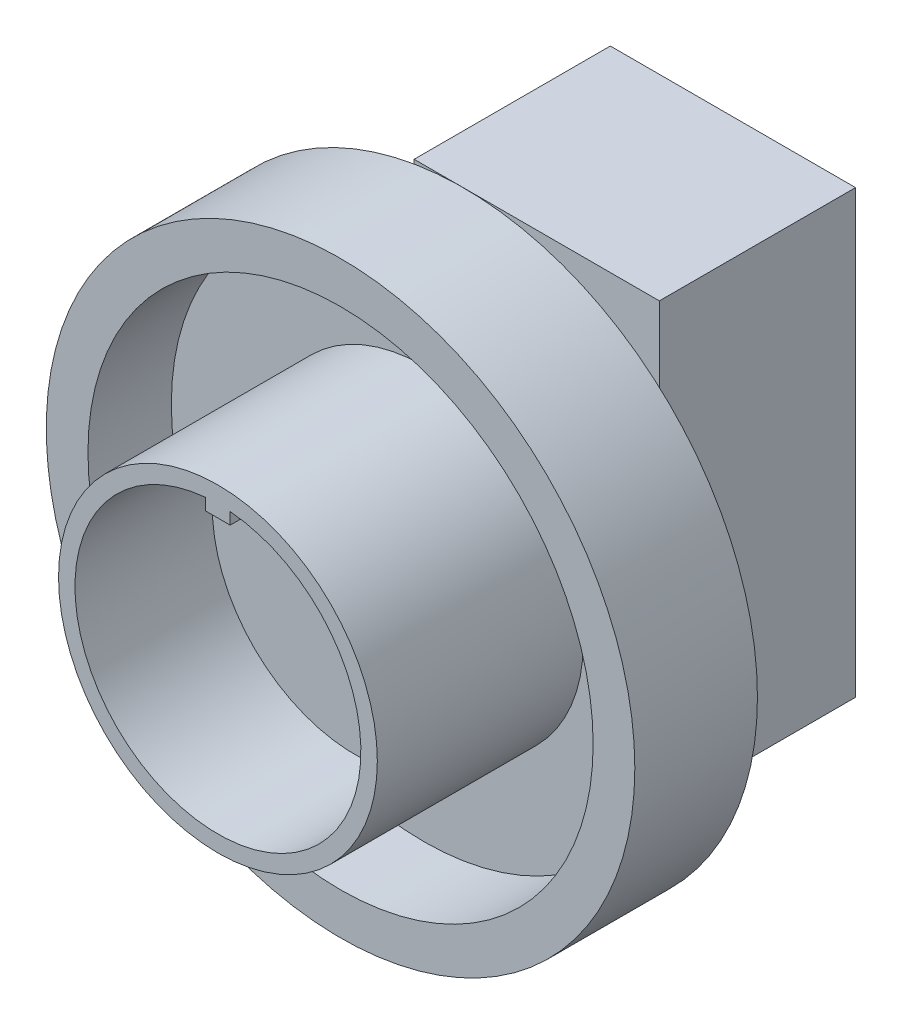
SolidWorks part; units mm, degrees
ref_plane "Alzado" through (0, 0, 0) normal (0, 0, 1) x (1, 0, 0)
ref_plane "Planta" through (0, 0, 0) normal (0, 1, 0) x (1, 0, 0)
ref_plane "Vista lateral" through (0, 0, 0) normal (1, 0, 0) x (0, 0, -1)
sketch "Croquis1" plane through (0, 0, 0) normal (1, 0, 0) x (0, 0, -1)
  line L0 (0, 0) -> (65, 0) construction
  line L1 (0, 32.5) -> (0, 29.15)
  line L2 (0, 29.15) -> (28, 29.15)
  line L3 (28, 29.15) -> (28, 0)
  line L4 (28, 0) -> (65, 0)
  line L5 (65, 0) -> (65, 25)
  line L6 (65, 25) -> (50, 25)
  line L7 (50, 25) -> (50, 60)
  line L8 (50, 60) -> (25, 60)
  line L9 (25, 60) -> (25, 51.5)
  line L10 (25, 51.5) -> (42, 51.5)
  line L11 (42, 51.5) -> (42, 32.5)
  line L12 (42, 32.5) -> (0, 32.5)
  dimension "D1" = 28
  dimension "D2" = 58.3
  dimension "D3" = 65
  dimension "D4" = 103
  dimension "D5" = 120
  dimension "D6" = 42
  dimension "D7" = 50
  dimension "D8" = 25
  dimension "D9" = 65
  dimension "D10" = 50
revolve "Revolución1" add sketch "Croquis1" angle 360 about L0
sketch "Croquis2" plane through (0, 0, 0) normal (0, 0, 1) x (1, 0, 0)
  line L1 (-2.5, 31.65) -> (2.5, 31.65)
  line L2 (-2.5, 31.65) -> (-2.5, 26.65)
  line L3 (-2.5, 26.65) -> (2.5, 26.65)
  line L4 (2.5, 31.65) -> (2.5, 26.65)
  line L5 (-2.5, 31.65) -> (2.5, 26.65) construction
  line L6 (-2.5, 26.65) -> (2.5, 31.65) construction
  circle A0 centre (0, 0) radius 29.15 construction
  circle A1 centre (0, 0) radius 29.15 construction
  point P0 (0, 29.15)
  dimension "D1" = 5
  dimension "D2" = 5
extrude "Saliente-Extruir1" add sketch "Croquis2" against normal up to surface (28 mm away)
sketch "Croquis3" plane through (0, 0, -65) normal (0, 0, -1) x (-1, 0, 0)
  line L1 (-25, 45) -> (25, 45)
  line L2 (-25, 45) -> (-25, -45)
  line L3 (-25, -45) -> (25, -45)
  line L4 (25, 45) -> (25, -45)
  line L5 (-25, 45) -> (25, -45) construction
  line L6 (-25, -45) -> (25, 45) construction
  point P0 (0, 0)
  dimension "D1" = 90
  dimension "D2" = 50
extrude "Saliente-Extruir2" add sketch "Croquis3" along normal blind 40
sketch "Croquis4" plane through (0, 0, -105) normal (0, 0, -1) x (-1, 0, 0)
  line L1 (-20.25, -40.5) -> (20.25, -40.5)
  line L2 (-20.25, -40.5) -> (-20.25, 40.5)
  line L3 (-20.25, 40.5) -> (20.25, 40.5)
  line L4 (20.25, -40.5) -> (20.25, 40.5)
  line L5 (-20.25, -40.5) -> (20.25, 40.5) construction
  line L6 (-20.25, 40.5) -> (20.25, -40.5) construction
  point P0 (0, 0)
  dimension "D1" = 40.5
  dimension "D2" = 81
extrude "Cortar-Extruir1" cut sketch "Croquis4" against normal offset from surface (32 mm away) 8
sketch "Croquis5" plane through (0, 0, -73) normal (0, 0, -1) x (-1, 0, 0)
  line L1 (11.05, -11.05) -> (-11.05, -11.05)
  line L2 (11.05, -11.05) -> (11.05, 11.05)
  line L3 (11.05, 11.05) -> (-11.05, 11.05)
  line L4 (-11.05, -11.05) -> (-11.05, 11.05)
  line L5 (11.05, -11.05) -> (-11.05, 11.05) construction
  line L6 (11.05, 11.05) -> (-11.05, -11.05) construction
  point P0 (0, 0)
  dimension "D1" = 22.1
  dimension "D2" = 22.1
extrude "Cortar-Extruir2" cut sketch "Croquis5" against normal blind 17
